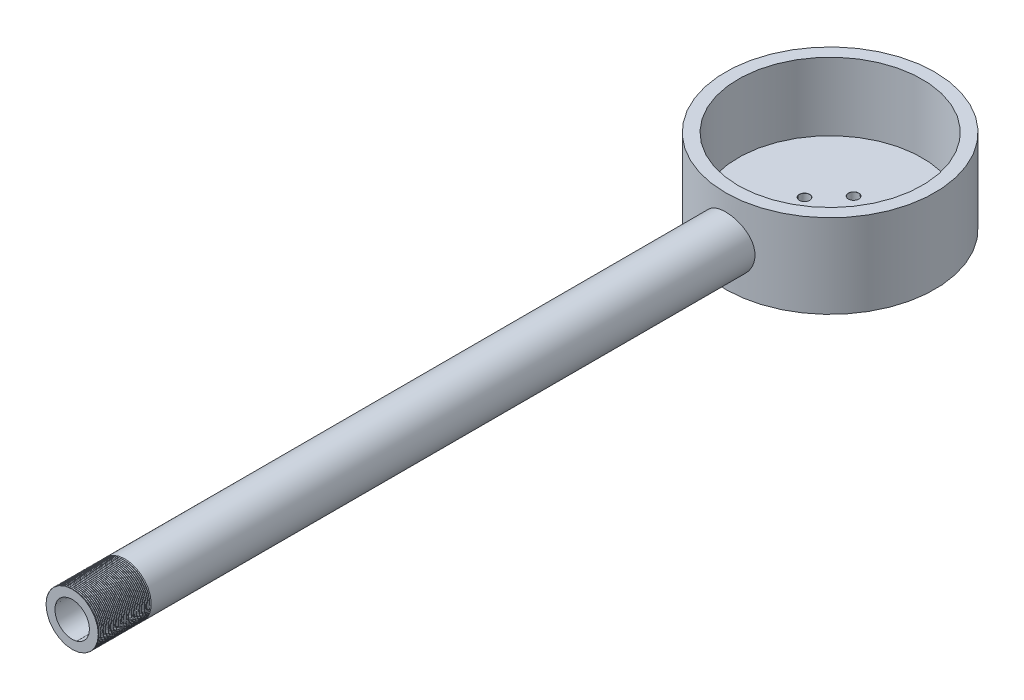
SolidWorks part; units mm, degrees
ref_plane "Front Plane" through (0, 0, 0) normal (0, 0, 1) x (1, 0, 0)
ref_plane "Top Plane" through (0, 0, 0) normal (0, 1, 0) x (1, 0, 0)
ref_plane "Right Plane" through (0, 0, 0) normal (1, 0, 0) x (0, 0, -1)
sketch "Sketch1" plane through (0, 0, 0) normal (0, 1, 0) x (1, 0, 0)
  circle A0 centre (0, 0) radius 25.4
  dimension "D1" = 50.8
extrude "Boss-Extrude4" add sketch "Sketch1" along normal blind 20.32
sketch "Sketch2" plane through (0, 20.32, 0) normal (0, 1, 0) x (1, 0, 0)
  circle A0 centre (0, 0) radius 22.352
  dimension "D1" = 44.704
extrude "Cut-Extrude1" cut sketch "Sketch2" against normal blind 16.51
sketch "Sketch3" plane through (0, 3.81, 0) normal (0, 1, 0) x (1, 0, 0)
  circle A0 centre (0, 0) radius 5.969 construction
  dimension "D1" = 11.938
hole_wizard "Tap Drill for M3x0.5 Tap1" positions "3DSketch1" profile "Sketch4" hole size "M3x0.5" standard "ANSI Metric"
sketch3d "3DSketch1"
  circle A0 centre (0, 3.81, 0) radius 5.969 construction
  point P0 (-0.268, 3.81, -5.963)
  point P4 (0, 9.779, 0)
sketch "Sketch4" plane through (-0.268, 3.81, -5.963) normal (1, 0, 0) x (0, 0, 1)
  line L0 (0, 0) -> (0, 3.81)
  line L1 (0, 3.81) -> (1.25, 3.81)
  line L2 (1.25, 3.81) -> (1.25, 0.025)
  line L3 (1.25, 0.025) -> (1.275, 0)
  line L5 (1.275, 0) -> (0, 0)
  line L6 (-1.25, 0.025) -> (-1.275, 0) construction
  line L11 (0, -6.35) -> (0, 107.95) construction
  dimension "Thru Hole Dia." = 2.5
  dimension "Thru Hole Depth" = 3.81
  dimension "Near C'Sink Dia." = 2.55
  dimension "Near C'Sink Angle" = 90
pattern_circular "CirPattern1" count 4 over 360 about axis through (0, 0, 0) along (0, 1, 0) of "Tap Drill for M3x0.5 Tap1"
sketch "Sketch5" plane through (0, 0, 0) normal (0, 0, 1) x (1, 0, 0)
  point P4 (0, 9.9517)
ref_plane "Plane1" through (0, 0, 22.86) normal (0, 0, 1) x (1, 0, 0)
sketch "Sketch6" plane through (0, 0, 22.86) normal (0, 0, 1) x (1, 0, 0)
  circle A0 centre (0, 9.9517) radius 6.35
  dimension "D1" = 12.7
extrude "Boss-Extrude5" add sketch "Sketch6" along normal blind 161.163
thread "Thread1" pitch 0.3969 start angle 0, offset 0, length 12.7, pitch 0.3969, diameter 12.7
ref_plane "Plane2" through (-6.35, 9.9517, 184.023) normal (0, -1, 0) x (-1, 0, 0)
sketch "Thread Profile1" plane through (-6.35, 9.9517, 184.023) normal (0, -1, 0) x (-1, 0, 0)
  line L0 (0, 0) -> (0, 0.3969) construction
  line L11 (0, 0) -> (0, 0.3473)
  line L12 (0, 0.3473) -> (-0.2148, 0.2232)
  line L13 (-0.2148, 0.2232) -> (-0.2148, 0.124)
  line L15 (-0.2148, 0.124) -> (0, 0)
  line L17 (-0.2148, 0.1736) -> (0, 0.1736) construction
  point P2 (0, 0)
  dimension "Pitch" = 0.3969
  dimension "Profile_Angle" = 60
  dimension "Profile_Land" = 0.0992
  dimension "Profile_Height" = 0.2148
sketch "Sketch7" plane through (0, 0, 184.023) normal (0, 0, 1) x (1, 0, 0)
  circle A0 centre (0, 9.9517) radius 4.2046
extrude "Cut-Extrude2" cut sketch "Sketch7" against normal up to next
